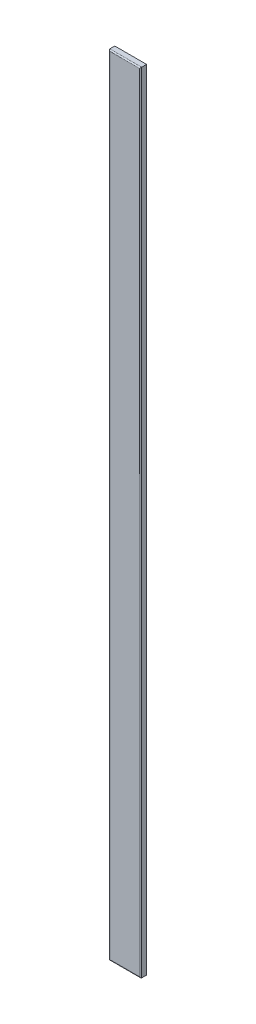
SolidWorks part; units mm, degrees
ref_plane "Спереди" through (0, 0, 0) normal (0, 0, 1) x (1, 0, 0)
ref_plane "Сверху" through (0, 0, 0) normal (0, 1, 0) x (1, 0, 0)
ref_plane "Справа" through (0, 0, 0) normal (1, 0, 0) x (0, 0, -1)
sketch "Эскиз1" plane through (0, 0, 0) normal (0, 0, 1) x (1, 0, 0)
  line L0 (-525.9, 1089.8) -> (525.9, 1089.8) construction
  line L1 (-442.1, 1089.8) -> (-527.1, 1089.8)
  line L2 (-442.1, 1089.8) -> (-442.1, -1019.8)
  line L3 (-442.1, -1019.8) -> (-527.1, -1019.8)
  line L4 (-527.1, 1089.8) -> (-527.1, -1019.8)
  line L5 (-527.1, 1088.6) -> (-527.1, -1029.8) construction
  line L6 (-442.1, -1004.8) -> (-442.1, 1004.8) construction
  line L8 (442.1, -1019.8) -> (527.1, -1019.8) construction
extrude "Бобышка-Вытянуть1" add sketch "Эскиз1" along normal blind 16
sketch "Эскиз2" plane through (0, 0, 16) normal (0, 0, 1) x (1, 0, 0)
  line L0 (-442.1, -1019.8) -> (-442.1, 1089.8) construction
  line L1 (-442.1, 923.8) -> (-462.1, 923.8)
  line L2 (-442.1, 923.8) -> (-442.1, 777.8)
  line L3 (-442.1, 777.8) -> (-462.1, 777.8)
  line L4 (-462.1, 923.8) -> (-462.1, 777.8)
  line L5 (436.8293, 1000.8) -> (-436.8293, 1000.8) construction
  line L6 (-442.1, 623.8) -> (-462.1, 623.8)
  line L7 (-442.1, 623.8) -> (-442.1, 477.8)
  line L8 (-442.1, 477.8) -> (-462.1, 477.8)
  line L9 (-462.1, 623.8) -> (-462.1, 477.8)
  line L10 (-442.1, -777.8) -> (-462.1, -777.8)
  line L11 (-442.1, -777.8) -> (-442.1, -923.8)
  line L12 (-442.1, -923.8) -> (-462.1, -923.8)
  line L13 (-462.1, -777.8) -> (-462.1, -923.8)
  line L14 (-436.8293, -1000.8) -> (436.8293, -1000.8) construction
  point P14 (-462.1, 850.8)
  point P15 (-462.1, 550.8)
  point P16 (-462.1, -850.8)
  dimension "D1" = 20
  dimension "D2" = 146
  dimension "D3" = 150
  dimension "D4" = 450
  dimension "D5" = 150
extrude "Вырез-Вытянуть1" [suppressed] cut sketch "Эскиз2" against normal up to next
fillet "Скругление1" radius 3 4 edges at (-484.6, 1089.8, 16) (-442.1, 35, 16) (-484.6, -1019.8, 16) (-527.1, 35, 16)
